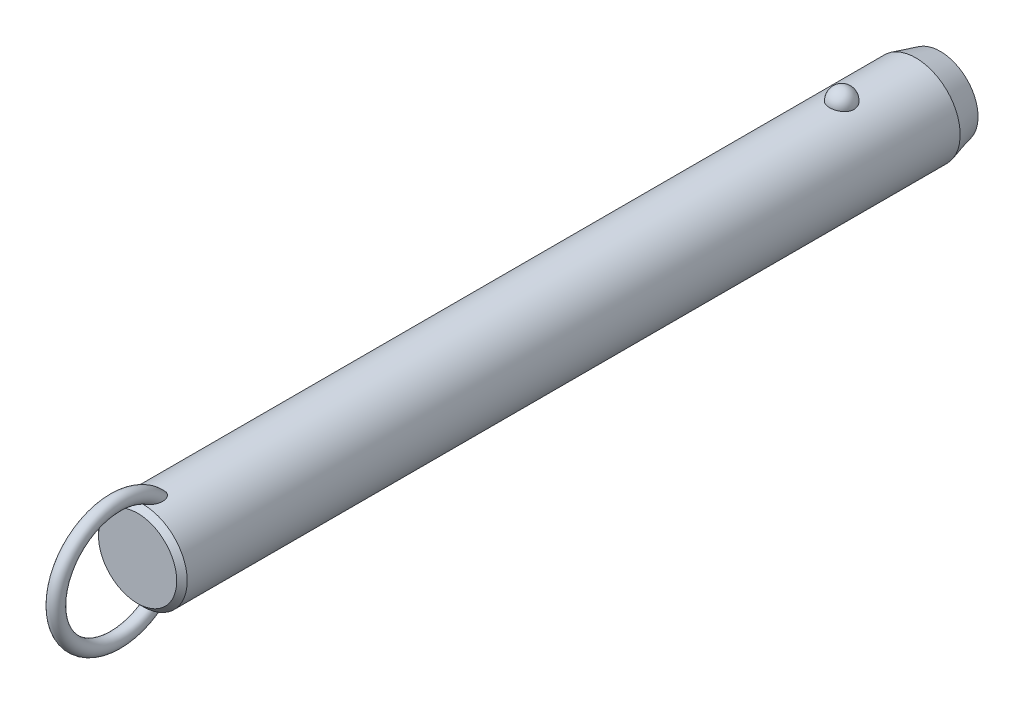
SolidWorks part; units mm, degrees
ref_plane "Front Plane" through (0, 0, 0) normal (0, 0, 1) x (1, 0, 0)
ref_plane "Top Plane" through (0, 0, 0) normal (0, 1, 0) x (1, 0, 0)
ref_plane "Right Plane" through (0, 0, 0) normal (1, 0, 0) x (0, 0, -1)
sketch "Sketch2" plane through (0, 0, 0) normal (0, 0, 1) x (1, 0, 0)
  circle A0 centre (0, 0) radius 12.7
  point P3 (0, 12.7)
  dimension "D1" = 25.4
extrude "Boss-Extrude1" add sketch "Sketch2" along normal blind 185.4
sketch "Sketch3" plane through (0, 0, 0) normal (0, 0, -1) x (-1, 0, 0)
  circle A0 centre (0, 0) radius 12.7
  dimension "D1" = 25.4
extrude "Boss-Extrude2" add sketch "Sketch3" along normal blind 31.7
chamfer "Chamfer1" distance 7 angle 15 1 edges at (-12.7, 0, -31.7)
sketch "Sketch12" plane through (0, 0, 0) normal (1, 0, 0) x (0, 0, -1)
  line L0 (-185.4, 12.7) -> (-185.4, -12.7) construction
  point P0 (-185.4, 0)
sketch "Sketch13" plane through (0, 0, 0) normal (1, 0, 0) x (0, 0, -1)
  circle A0 centre (-204.45, 0) radius 19.05
  point P2 (-185.4, 0)
  dimension "D1" = 38.1
sketch "Sketch14" plane through (0, 0, 0) normal (0, 1, 0) x (1, 0, 0)
  circle A0 centre (0, -187.4) radius 2
  point P2 (0, -185.4)
  dimension "D1" = 4
sweep "Sweep1" add profiles "Sketch14" path "Sketch13"
sketch "Sketch15" plane through (0, 0, 185.4) normal (0, 0, 1) x (1, 0, 0)
  circle A0 centre (0, 0) radius 12.7
  dimension "D1" = 25.4
extrude "Boss-Extrude3" add sketch "Sketch15" along normal blind 12.7
chamfer "Chamfer2" distance 1.5 angle 45 1 edges at (12.7, 0, 198.1)
sketch "Sketch18" plane through (0, 0, 0) normal (1, 0, 0) x (0, 0, -1)
  line L0 (24.7, 12.7) -> (-190.251, 12.7) construction
  line L1 (3.5, 16.2) -> (3.5, 9.2)
  line L2 (-190.251, -12.7) -> (24.7, -12.7) construction
  arc A0 (3.5, 16.2) -> (3.5, 9.2) centre (3.5, 12.7) ccw
  point P4 (0, 12.7)
  dimension "D1" = 28.9
revolve "Revolve1" add sketch "Sketch18" angle 360 about L1
